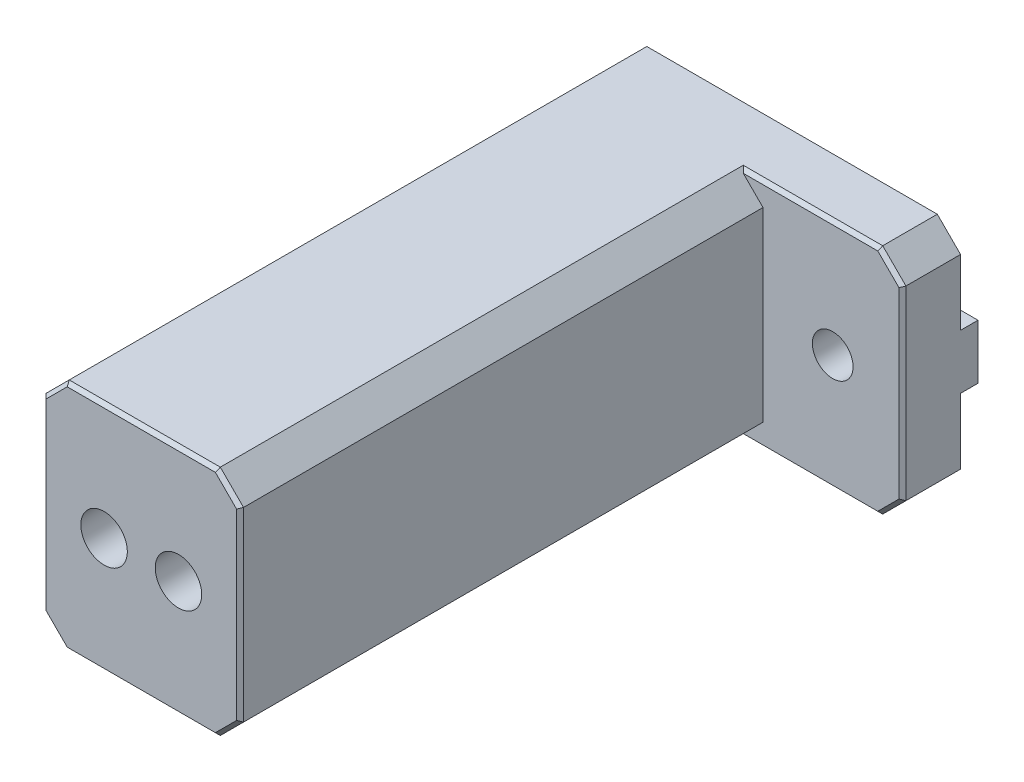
SolidWorks part; units mm, degrees
ref_plane "Ebene vorne" through (0, 0, 0) normal (0, 0, 1) x (1, 0, 0)
ref_plane "Ebene oben" through (0, 0, 0) normal (0, 1, 0) x (1, 0, 0)
ref_plane "Ebene rechts" through (0, 0, 0) normal (1, 0, 0) x (0, 0, -1)
sketch "Skizze1" plane through (0, 0, 0) normal (0, 0, 1) x (1, 0, 0)
  line L1 (-14.5, -10) -> (14.5, -10)
  line L2 (-14.5, -10) -> (-14.5, 10)
  line L3 (-14.5, 10) -> (14.5, 10)
  line L4 (14.5, -10) -> (14.5, 10)
  line L5 (-14.5, -10) -> (14.5, 10) construction
  line L6 (-14.5, 10) -> (14.5, -10) construction
  point P0 (0, 0)
  dimension "D1" = 20
  dimension "D2" = 29
extrude "Aufsatz-Linear austragen1" add sketch "Skizze1" along normal blind 50
sketch "Skizze2" plane through (0, 0, 0) normal (0, 0, -1) x (-1, 0, 0)
  line L0 (14.5, 10) -> (14.5, -10) construction
  line L1 (-14.5, -2.35) -> (14.5, -2.35)
  line L2 (-14.5, -2.35) -> (-14.5, 2.35)
  line L3 (-14.5, 2.35) -> (14.5, 2.35)
  line L4 (14.5, -2.35) -> (14.5, 2.35)
  line L5 (-14.5, -2.35) -> (14.5, 2.35) construction
  line L6 (-14.5, 2.35) -> (14.5, -2.35) construction
  point P0 (0, 0)
  dimension "D1" = 4.7
extrude "Aufsatz-Linear austragen2" add sketch "Skizze2" along normal blind 1.5
hole_wizard "Ø4.0 (4) Durchmesser Bohrung1" positions "Skizze3" profile "Skizze4" hole size "Ø4.0" standard "DIN"
sketch "Skizze3" plane through (0, 0, 50) normal (0, 0, 1) x (1, 0, 0)
  line L0 (-14.5, 10) -> (-14.5, -10) construction
  point P0 (-9.2, 0)
  point P2 (-2.8, 0)
  dimension "D1" = 6.4
  dimension "D2" = 5.3
sketch "Skizze4" plane through (-9.2, 0, 50) normal (1, 0, 0) x (0, -1, 0)
  line L0 (0, 0) -> (0, 9)
  line L1 (0, 9) -> (2, 9)
  line L2 (2, 9) -> (2, 0)
  line L5 (2, 0) -> (0, 0)
  line L10 (0, 9) -> (-2, 9) construction
  line L11 (0, -6.35) -> (0, 107.95) construction
  dimension "Bohrerdurchmesser" = 4
  dimension "Bohrungstiefe" = 9
  dimension "Spitzenwinkel" = 180
sketch "Skizze5" plane through (0, 0, 50) normal (0, 0, 1) x (1, 0, 0)
  line L0 (14.5, 10) -> (-14.5, 10) construction
  line L1 (14.5, -10) -> (2.5, -10)
  line L2 (14.5, -10) -> (14.5, 10)
  line L3 (14.5, 10) -> (2.5, 10)
  line L4 (2.5, -10) -> (2.5, 10)
  circle A0 centre (-2.8, 0) radius 2 construction
  dimension "D1" = 5.3
extrude "Schnitt-Linear austragen1" cut sketch "Skizze5" against normal blind 45
hole_wizard "Ø3.5 (3.5) Durchmesser Bohrung1" positions "Skizze6" profile "Skizze7" hole size "Ø3.5" standard "DIN"
sketch "Skizze6" plane through (0, 0, 5) normal (0, 0, 1) x (1, 0, 0)
  line L0 (2.5, 10) -> (2.5, -10) construction
  point P0 (8.5, 0)
  dimension "D1" = 6
sketch "Skizze7" plane through (8.5, 0, 5) normal (1, 0, 0) x (0, -1, 0)
  line L0 (0, 0) -> (0, 6.5)
  line L1 (0, 6.5) -> (1.75, 6.5)
  line L2 (1.75, 6.5) -> (1.75, 0)
  line L5 (1.75, 0) -> (0, 0)
  line L11 (0, -6.35) -> (0, 107.95) construction
  dimension "Bohrerdurchmesser" = 3.5
  dimension "Bohrungstiefe" = 6.5
chamfer "Fase1" distance 2 angle 45 6 edges at (14.5, 10, 2.5) (14.5, -10, 2.5) (-14.5, -10, 25) (2.5, -10, 27.5) (-14.5, 10, 25) (2.5, 10, 27.5)
chamfer "Fase2" distance 0.3 angle 45 13 edges at (6.5, -10, 5) (13.5, -9, 5) (14.5, 0, 5) (13.5, 9, 5) (6.5, 10, 5) (1.5, 9, 50) (-6, 10, 50) (-13.5, 9, 50) (-14.5, 0, 50) (-13.5, -9, 50) (2.5, 0, 50) (1.5, -9, 50) (-6, -10, 50)
